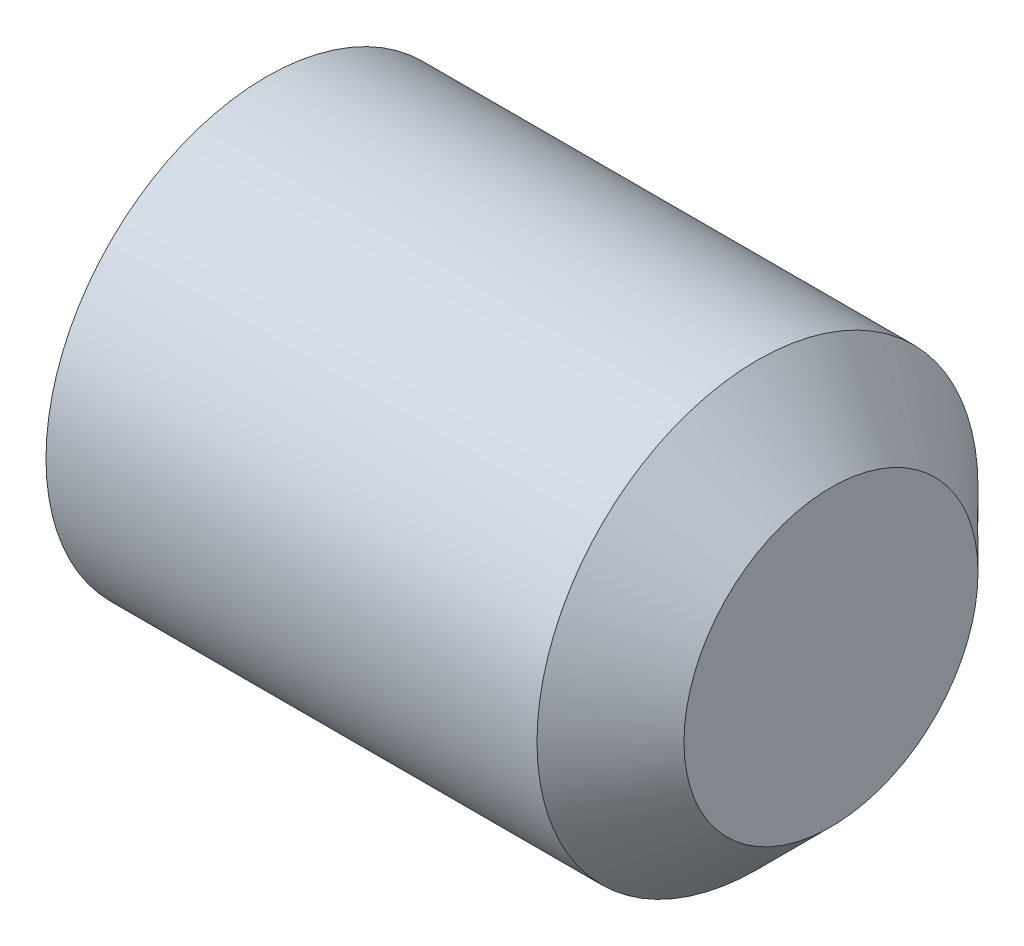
SolidWorks part; units mm, degrees
ref_plane "Plane1" through (0, 0, 0) normal (0, 0, 1) x (1, 0, 0)
ref_plane "Plane2" through (0, 0, 0) normal (0, 1, 0) x (1, 0, 0)
ref_plane "Plane3" through (0, 0, 0) normal (1, 0, 0) x (0, 0, -1)
sketch "BodySke" plane through (0, 0, 0) normal (0, 0, 1) x (1, 0, 0)
  line L0 (0, 0) -> (0, 2.4455)
  line L1 (0, 2.4455) -> (0.3201, 3)
  line L2 (0.3201, 3) -> (7, 3)
  line L3 (7, 3) -> (8, 2)
  line L4 (8, 0) -> (0, 0)
  line L5 (-12.7, 0) -> (88.9, 0) construction
  line L6 (8, 2) -> (8, 0)
  line L7 (8, 2) -> (8, 11.525) construction
  line L8 (0, -2.4455) -> (0.3201, -3) construction
  line L9 (1, 15.875) -> (1, -3.175) construction
  line L10 (7, -3) -> (8, -2) construction
  dimension "Length" = 8
  dimension "Diameter" = 6
  dimension "Drive_ch_ang" = 60
  dimension "Minor_dia" = 4.891
  dimension "Cup_nose_ang" = 45
  dimension "Cup_dia" = 4
  dimension "Advance" = 1
revolve "BaseBody" add sketch "BodySke" angle 360 about L5
sketch "Sketch2" plane through (0, 0, 0) normal (-1, 0, 0) x (0, 0, 1)
  line L0 (0.866, 1.5) -> (-0.866, 1.5)
  line L1 (-0.866, 1.5) -> (-1.7321, 0)
  line L2 (0.866, 1.5) -> (1.7321, 0)
  line L3 (0.866, -1.5) -> (1.7321, 0)
  line L4 (0.866, -1.5) -> (-0.866, -1.5)
  line L5 (-0.866, -1.5) -> (-1.7321, 0)
  dimension "Hex_size" = 3
  dimension "D2" = 1.5
  dimension "D3" = 1.5
extrude "Hex" cut sketch "Sketch2" against normal blind 3.5
sketch "ThdSchSke" plane through (0, 0, 0) normal (0, 0, 1) x (1, 0, 0)
  line L0 (0.3201, -2.4455) -> (-0.0681, -3)
  line L1 (0.3201, -2.4455) -> (0.7084, -3)
  line L2 (0.7084, -3) -> (0.7084, -3.75)
  line L3 (-3.175, 0) -> (5.1513, 0) construction
  line L5 (0.7084, -3.75) -> (-0.0681, -3.75)
  line L6 (-0.0681, -3.75) -> (-0.0681, -3)
  line L8 (0.3201, 3) -> (0.3201, -3) construction
  dimension "Thread_minor" = 4.891
  dimension "Diameter" = 6
  dimension "SideAngle" = 55
  dimension "VeeAngle" = 70
  dimension "Overcut" = 7.5
revolve "ThreadSchematic" [suppressed] cut sketch "ThdSchSke" angle 360 about L3
pattern_linear "ThdSchPat" [suppressed]
equation "\"D2@Sketch2\" = \"Hex_size@Sketch2\" / 2"
equation "\"D3@Sketch2\" = \"Hex_size@Sketch2\" / 2"
equation "\"Thread_minor@ThreadCosmetic\" = \"Minor_dia@BodySke\""
equation "\"Thread_minor@ThdSchSke\" = \"Thread_minor@ThreadCosmetic\""
equation "\"Diameter@ThdSchSke\" = \"Diameter@BodySke\""
equation "\"Overcut@ThdSchSke\" = \"Diameter@BodySke\" * 1.25"
equation "\"Num_threads@ThdSchPat\" = int( (\"Length@BodySke\" - ( ( ( \"Diameter@BodySke\" - \"Minor_dia@BodySke\" ) * 0.5 ) / tan( \"Drive_ch_ang@BodySke\" * 0.017453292 ) ) - ( ( ( \"Diameter@BodySke\" - \"Cup_dia@BodySk"
equation "\"Advance@ThdSchPat\" = (\"Length@BodySke\" - ( ( ( \"Diameter@BodySke\" - \"Minor_dia@BodySke\" ) * 0.5 ) / tan( \"Drive_ch_ang@BodySke\" * 0.017453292 ) ) - ( ( ( \"Diameter@BodySke\" - \"Cup_dia@BodySke\" ) * 0."
equation "' \"Num_threads@ThdSchPat\" = \"Num_threads@ThdSchPat\" - sgn( \"Num_threads@ThdSchPat\" - 1) '---chamfered tips only---"
